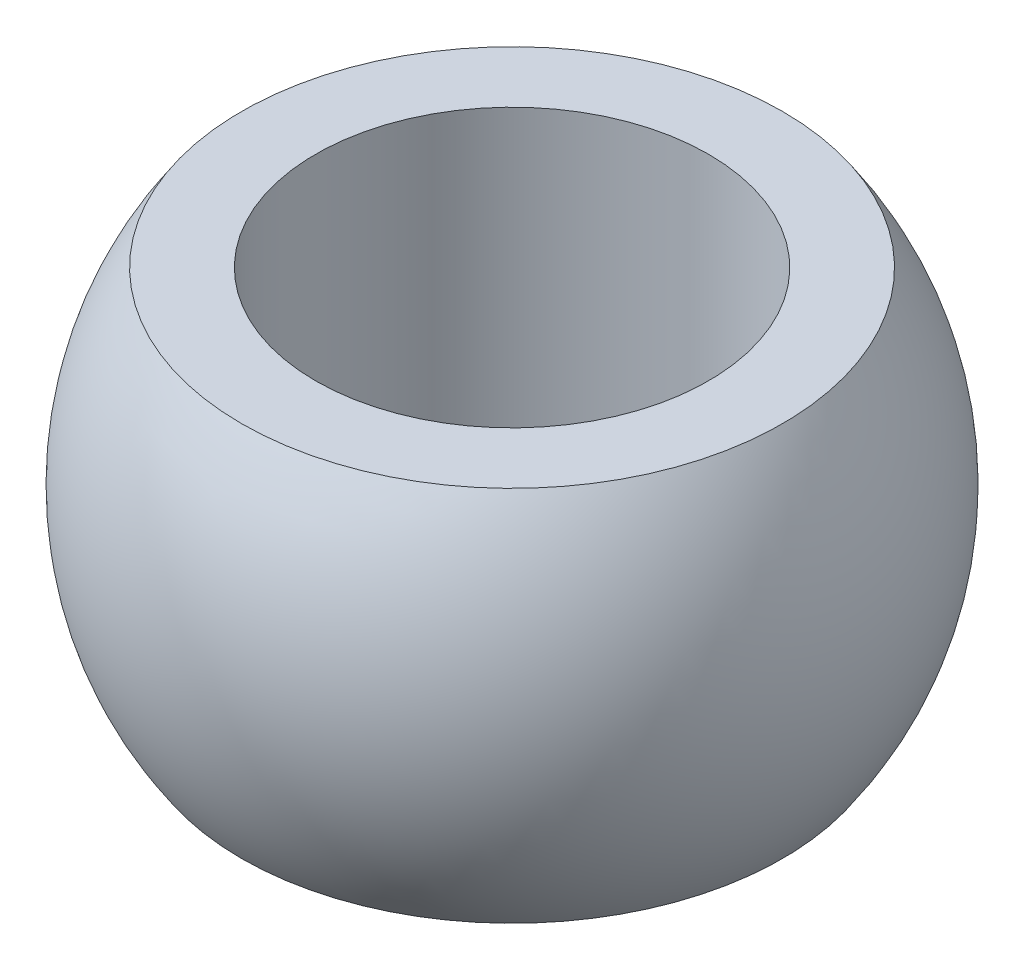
SolidWorks part; units mm, degrees
ref_plane "Plane1" through (0, 0, 0) normal (0, 0, 1) x (1, 0, 0)
ref_plane "Plane2" through (0, 0, 0) normal (0, 1, 0) x (1, 0, 0)
ref_plane "Plane3" through (0, 0, 0) normal (1, 0, 0) x (0, 0, -1)
sketch "Esquisse1" plane through (0, 0, 0) normal (0, 0, 1) x (1, 0, 0)
  line L0 (0, 20.7018) -> (0, -22.6936) construction
  line L1 (-20.106, 14) -> (-14.6, 14)
  line L2 (-20.106, -14) -> (-14.6, -14)
  line L3 (-14.6, 14) -> (-14.6, -14)
  arc A0 (-20.106, 14) -> (-20.106, -14) centre (0, 0) ccw
  dimension "D1" = 28
  dimension "D3" = 49
  dimension "D2" = 14.6
  dimension "D4" = 14
revolve "Base-Révolution" add sketch "Esquisse1" angle 360 about L0
equation "\"D4@Esquisse1\" = \"D1@Esquisse1\" / 2"
